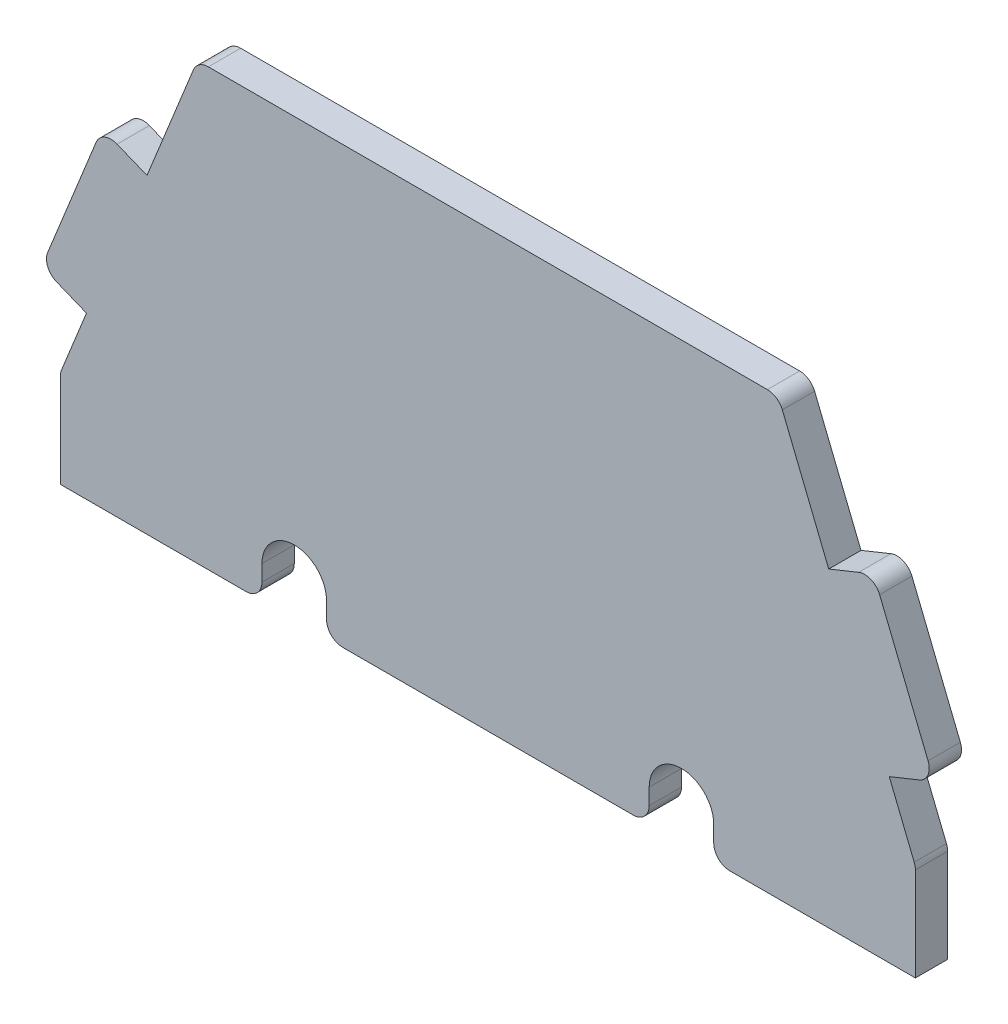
SolidWorks part; units mm, degrees
ref_plane "Plano frontal" through (0, 0, 0) normal (0, 0, 1) x (1, 0, 0)
ref_plane "Plano superior" through (0, 0, 0) normal (0, 1, 0) x (1, 0, 0)
ref_plane "Plano direito" through (0, 0, 0) normal (1, 0, 0) x (0, 0, -1)
sketch "Esboço1" plane through (0, 0, 0) normal (0, 0, 1) x (1, 0, 0)
  line L0 (-26.4269, -7.3195) -> (-24.881, -3.5)
  line L1 (-17.326, 13.5) -> (17.326, 13.5)
  line L2 (-26.5, -7.6947) -> (-26.5, -13.5)
  line L3 (-26.5, -13.5) -> (-15, -13.5)
  line L4 (-12, -13.5) -> (-12, -11.5) construction
  line L5 (-26.5, 13.5) -> (26.5, -13.5) construction
  line L6 (-26.5, -13.5) -> (26.5, 13.5) construction
  line L7 (-21.129, 5.7695) -> (-18.2529, 12.8752)
  line L8 (-24.881, -3.5) -> (-26.7348, -2.7496)
  line L9 (0, 0) -> (0, -13.5) construction
  line L10 (-21.129, 5.7695) -> (-22.9829, 6.5199)
  line L11 (-27.2866, -1.4475) -> (-24.2851, 5.9681)
  line L12 (21.129, 5.7695) -> (18.2529, 12.8752)
  line L13 (21.129, 5.7695) -> (22.9829, 6.5199)
  line L14 (26.4269, -7.3195) -> (24.881, -3.5)
  line L15 (24.881, -3.5) -> (26.7348, -2.7496)
  line L16 (27.2866, -1.4475) -> (24.2851, 5.9681)
  line L17 (26.5, -7.6947) -> (26.5, -13.5)
  line L18 (-14, -12.5) -> (-14, -11.5)
  line L19 (-10, -12.5) -> (-10, -11.5)
  line L20 (12, -13.5) -> (12, -11.5) construction
  line L21 (14, -12.5) -> (14, -11.5)
  line L22 (10, -12.5) -> (10, -11.5)
  line L23 (-9, -13.5) -> (9, -13.5)
  line L24 (15, -13.5) -> (26.5, -13.5)
  arc A0 (26.4269, -7.3195) -> (26.5, -7.6947) centre (25.5, -7.6947) cw
  arc A1 (-10, -11.5) -> (-14, -11.5) centre (-12, -11.5) ccw
  arc A2 (-26.4269, -7.3195) -> (-26.5, -7.6947) centre (-25.5, -7.6947) ccw
  arc A3 (10, -11.5) -> (14, -11.5) centre (12, -11.5) cw
  arc A4 (-26.7348, -2.7496) -> (-27.2866, -1.4475) centre (-26.3597, -1.8227) cw
  arc A5 (-22.9829, 6.5199) -> (-24.2851, 5.9681) centre (-23.3581, 5.5929) ccw
  arc A6 (-18.2529, 12.8752) -> (-17.326, 13.5) centre (-17.326, 12.5) cw
  arc A7 (18.2529, 12.8752) -> (17.326, 13.5) centre (17.326, 12.5) ccw
  arc A8 (22.9829, 6.5199) -> (24.2851, 5.9681) centre (23.3581, 5.5929) cw
  arc A9 (26.7348, -2.7496) -> (27.2866, -1.4475) centre (26.3597, -1.8227) ccw
  arc A10 (14, -12.5) -> (15, -13.5) centre (15, -12.5) ccw
  arc A11 (10, -12.5) -> (9, -13.5) centre (9, -12.5) cw
  arc A12 (-10, -12.5) -> (-9, -13.5) centre (-9, -12.5) ccw
  arc A13 (-14, -12.5) -> (-15, -13.5) centre (-15, -12.5) cw
  point P0 (0, 0)
  point P22 (-12, -12.5)
  point P29 (12, -12.5)
  point P36 (26.5, -7.5)
  point P39 (-26.5, -7.5)
  point P42 (-27.6618, -2.3744)
  point P45 (-23.9099, 6.895)
  point P48 (-18, 13.5)
  point P51 (18, 13.5)
  point P54 (23.9099, 6.895)
  point P57 (27.6618, -2.3744)
  dimension "D12" = 1
  dimension "D1" = 27
  dimension "D2" = 53
  dimension "D3" = 6
  dimension "D4" = 18
  dimension "D5" = 3
  dimension "D6" = 10
  dimension "D7" = 10
  dimension "D9" = 4
  dimension "D10" = 4
  dimension "D11" = 10
extrude "Ressalto-extrusão1" add sketch "Esboço1" along normal blind 2
